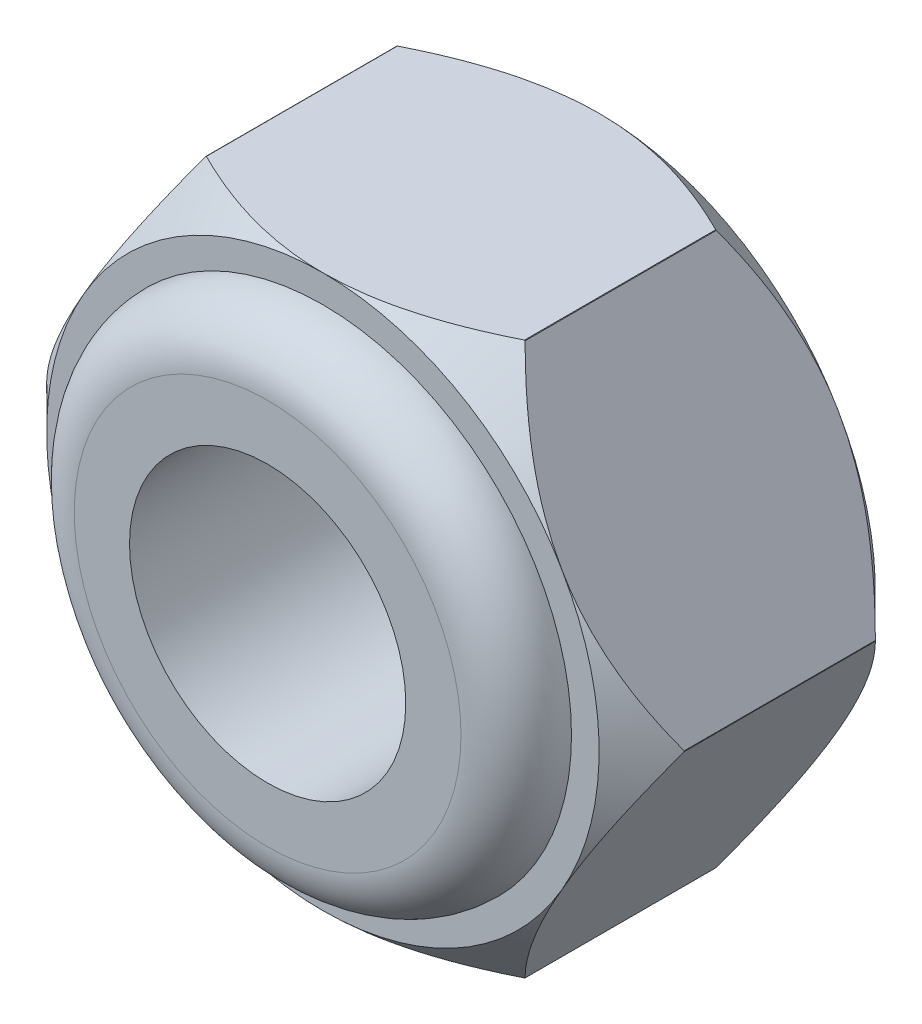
SolidWorks part; units mm, degrees
ref_plane "Plan1" through (0, 0, 0) normal (0, 0, 1) x (1, 0, 0)
ref_plane "Plan2" through (0, 0, 0) normal (0, 1, 0) x (1, 0, 0)
ref_plane "Plan3" through (0, 0, 0) normal (1, 0, 0) x (0, 0, -1)
sketch "Esquisse1" plane through (0, 0, 0) normal (0, 0, 1) x (1, 0, 0)
  circle A0 centre (0, 0) radius 5.77
  point P1 (5, 0)
  point P7 (0, 5)
  point P15 (0, -5)
  dimension "D1" = 11.54
extrude "Base-Extrusion" add sketch "Esquisse1" along normal blind 5
sketch "Esquisse4"
  circle A0 centre (0, 0) radius 4.5
  dimension "D1" = 9
chamfer "Chanfrein1" distance 0.77 angle 45 2 edges at (5.77, 0, 5) (5.77, 0, 0)
extrude "Boss.-Extru.1" add sketch "Esquisse4" along normal blind 1
sketch "Esquisse2" plane through (0, 0, 5) normal (0, 0, 1) x (1, 0, 0)
  line L0 (-2.8868, -5) -> (2.8868, -5)
  line L1 (-5.7735, 0) -> (-2.8868, -5)
  line L2 (2.8868, 5) -> (5.7735, 0)
  line L3 (-10, 0) -> (10, 0) construction
  line L4 (0, 10) -> (0, -10) construction
  line L5 (-2.8868, 5) -> (2.8868, 5)
  line L6 (5.7735, 0) -> (2.8868, -5)
  line L7 (-2.8868, 5) -> (-5.7735, 0)
  circle A0 centre (0, 0) radius 10
  point P1 (5, 0)
  point P3 (0, -5)
  point P6 (0, -5)
  point P7 (0, 5)
  point P16 (0, 5)
extrude "Enlèv. mat.-Extru.1" cut sketch "Esquisse2" against normal blind 5
fillet "Congé1" radius 1 1 edges at (4.5, 0, 6)
sketch "Esquisse5" plane through (0, 0, 6) normal (0, 0, 1) x (1, 0, 0)
  circle A0 centre (0, 0) radius 2.5
  dimension "D1" = 5
extrude "Enlèv. mat.-Extru.2" cut sketch "Esquisse5" against normal through all
sketch "Esq_WRNL_Compact001" plane through (0, 0, 0) normal (0, 0, 1) x (1, 0, 0)
  line L0 (-7.344, -6) -> (-7.344, 6)
  line L1 (7.344, -6) -> (7.344, 6)
  line L2 (-7.344, -6) -> (7.344, -6)
  line L3 (-7.344, 6) -> (7.344, 6)
